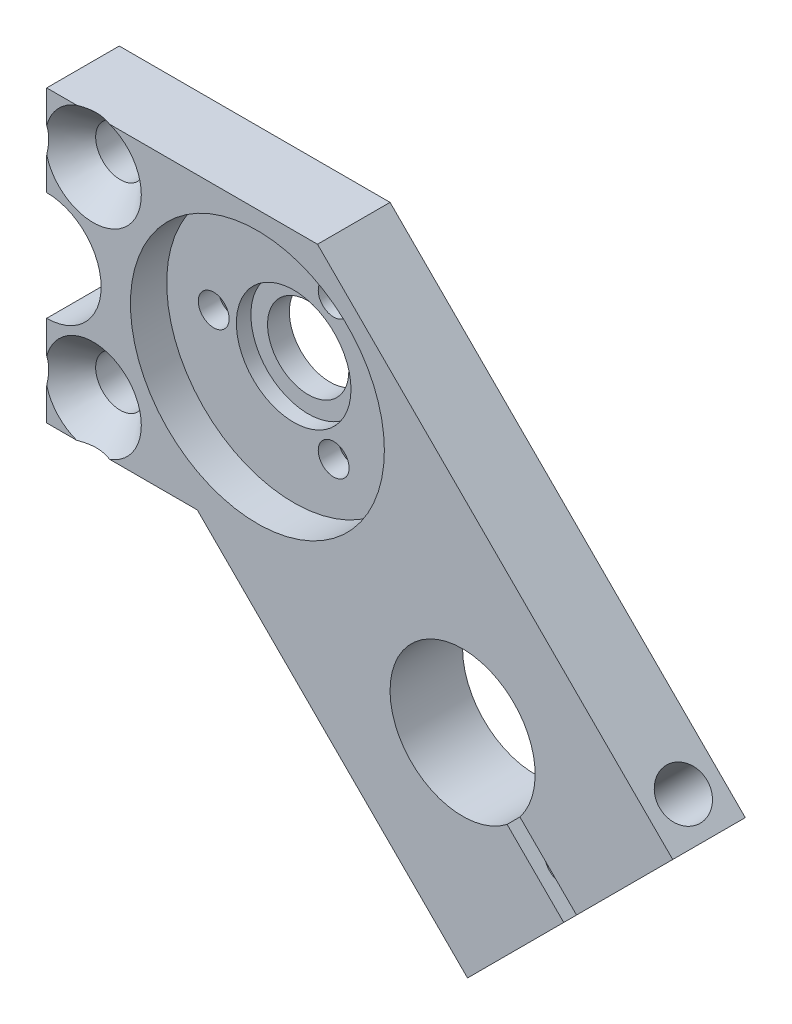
SolidWorks part; units mm, degrees
ref_plane "Front Plane" through (0, 0, 0) normal (0, 0, 1) x (1, 0, 0)
ref_plane "Top Plane" through (0, 0, 0) normal (0, 1, 0) x (1, 0, 0)
ref_plane "Right Plane" through (0, 0, 0) normal (1, 0, 0) x (0, 0, -1)
sketch "Sketch1" plane through (0, 0, 0) normal (0, 0, 1) x (1, 0, 0)
  line L0 (-18.4404, -4.7625) -> (-18.4404, -12.7)
  line L1 (-5.2605, -12.7) -> (18.3916, -36.3521)
  line L2 (18.3916, -36.3521) -> (26.8106, -27.9331)
  line L3 (36.3521, -18.3916) -> (5.2605, 12.7)
  line L4 (0, 0) -> (-24.2979, 0) construction
  line L5 (-13.0393, 13.0393) -> (27.8682, -27.8682) construction
  line L6 (22.9767, -21.8542) -> (27.9331, -26.8106)
  line L7 (26.8106, -27.9331) -> (21.8542, -22.9767)
  line L8 (27.9331, -26.8106) -> (36.3521, -18.3916)
  line L9 (-18.4404, 12.7) -> (-18.4404, 4.7625)
  line L10 (-18.4404, 12.7) -> (5.2605, 12.7)
  line L11 (-18.4404, -12.7) -> (-5.2605, -12.7)
  line L12 (-18.4404, 4.7625) -> (-18.4404, -4.7625) construction
  circle A0 centre (0, 0) radius 3.556
  arc A1 (22.9767, -21.8542) -> (21.8542, -22.9767) centre (17.9605, -17.9605) ccw
  arc A2 (-18.4404, -4.7625) -> (-18.4404, 4.7625) centre (-18.4404, 0) ccw
  dimension "D5" = 7.112
  dimension "D6" = 12.7
  dimension "D7" = 25.4
  dimension "D12" = 12.7
  dimension "D13" = 18.4404
  dimension "D14" = 9.525
  dimension "D16" = 18.4404
  dimension "D2" = 135
  dimension "D3" = 43.9701
  dimension "D4" = 12.7
  dimension "D8" = 0.7937
  dimension "D9" = 1.5875
  dimension "D10" = 25.4
  dimension "D11" = 25.4
  dimension "D15" = 12.7
extrude "Extrude1" add sketch "Sketch1" along normal blind 6.35
hole_wizard "CSK for #8 Flat Head Machine Screw1" positions "3DSketch1" profile "Sketch2" countersink size "#8" standard "Ansi Inch"
sketch3d "3DSketch1"
  line L0 (5.2605, 12.7, 6.35) -> (-18.4404, 12.7, 6.35) construction
  line L1 (-18.4404, -12.7, 6.35) -> (-5.2605, -12.7, 6.35) construction
  line L2 (-18.4404, 12.7, 6.35) -> (-18.4404, 4.7625, 6.35) construction
  point P0 (-14.3764, 8.7376, 6.35)
  point P2 (-14.3764, -8.7376, 6.35)
  dimension "D1" = 3.9624
  dimension "D2" = 3.9624
  dimension "D3" = 4.064
  dimension "D4" = 4.064
sketch "Sketch2" plane through (-14.3764, 8.7376, 6.35) normal (1, 0, 0) x (0, -1, 0)
  line L0 (0, 0) -> (0, 6.35)
  line L1 (0, 6.35) -> (2.1526, 6.35)
  line L2 (2.1526, 6.35) -> (2.1526, 2.3741)
  line L3 (2.1526, 2.3741) -> (4.2164, 0)
  line L5 (4.2164, 0) -> (0, 0)
  line L6 (-2.1526, 2.3741) -> (-4.2164, 0) construction
  line L11 (0, -6.35) -> (0, 107.95) construction
  dimension "Thru Hole Dia." = 4.3053
  dimension "Thru Hole Depth" = 6.35
  dimension "Near C'Sink Dia." = 8.4328
  dimension "Near C'Sink Angle" = 82
sketch "Sketch3" plane through (0, 0, 6.35) normal (0, 0, 1) x (1, 0, 0)
  circle A0 centre (0, 0) radius 11.1125
  dimension "D1" = 22.225
extrude "Cut-Extrude1" cut sketch "Sketch3" against normal blind 3.175
sketch "Sketch4" plane through (0, 0, 3.175) normal (0, 0, 1) x (1, 0, 0)
  circle A0 centre (0, 0) radius 5.0165
  dimension "D1" = 10.033
extrude "Cut-Extrude2" cut sketch "Sketch4" against normal blind 1.27
sketch "Sketch5" plane through (0, 0, 3.175) normal (0, 0, 1) x (1, 0, 0)
  circle A0 centre (0, 0) radius 7.0104 construction
  point P3 (-7.0104, 0)
  dimension "D1" = 14.0208
hole_wizard "CSK for M2.5 Flat Head Machine Screw1" positions "3DSketch2" profile "Sketch6" countersink size "M2.5" standard "Ansi Metric"
sketch3d "3DSketch2"
  point P0 (-7.0004, 0, 0)
sketch "Sketch6" plane through (-7.0004, 0, 0) normal (1, 0, 0) x (0, 1, 0)
  line L0 (0, 0) -> (0, 6.575)
  line L1 (0, 6.575) -> (1.35, 6.575)
  line L2 (1.35, 6.575) -> (1.35, 1.4)
  line L3 (1.35, 1.4) -> (2.75, 0)
  line L5 (2.75, 0) -> (0, 0)
  line L6 (-1.35, 1.4) -> (-2.75, 0) construction
  line L11 (0, -6.35) -> (0, 107.95) construction
  dimension "Thru Hole Dia." = 2.7
  dimension "Thru Hole Depth" = 6.575
  dimension "Near C'Sink Dia." = 5.5
  dimension "Near C'Sink Angle" = 90
pattern_circular "CirPattern1" count 3 over 360 about axis through (0, 0, 0) along (0, 0, 1) of "CSK for M2.5 Flat Head Machine Screw1"
hole_wizard "#8 Clearance Hole1" positions "3DSketch3" profile "Sketch7" hole size "#8" standard "Ansi Inch"
sketch3d "3DSketch3"
  line L0 (-5.2605, -12.7, 0) -> (18.3916, -36.3521, 0) construction
  line L1 (18.3916, -36.3521, 6.35) -> (18.3916, -36.3521, 0) construction
  point P0 (16.1465, -34.107, 3.175)
  dimension "D1" = 3.175
  dimension "D2" = 3.175
sketch "Sketch7" plane through (16.1465, -34.107, 3.175) normal (0, 0, 1) x (0.7071, -0.7071, 0)
  line L0 (0, 0) -> (0, 13.9934)
  line L1 (0, 13.9934) -> (2.1526, 12.7)
  line L2 (2.1526, 12.7) -> (2.1526, 0)
  line L5 (2.1526, 0) -> (0, 0)
  line L10 (0, 13.9934) -> (-2.1527, 12.7) construction
  line L11 (0, -6.35) -> (0, 107.95) construction
  dimension "Hole Dia." = 4.3053
  dimension "Hole Depth" = 12.7
  dimension "Drill Angle" = 118
hole_wizard "#8-32 Tapped Hole1" positions "3DSketch4" profile "Sketch8" tap size "#8-32" standard "Ansi Inch"
sketch3d "3DSketch4"
  line L0 (36.3521, -18.3916, 6.35) -> (36.3521, -18.3916, 0) construction
  line L1 (36.3521, -18.3916, 6.35) -> (5.2605, 12.7, 6.35) construction
  point P0 (34.107, -16.1465, 3.175)
  dimension "D1" = 3.175
  dimension "D2" = 3.175
sketch "Sketch8" plane through (34.107, -16.1465, 3.175) normal (0, 0, 1) x (-0.7071, 0.7071, 0)
  line L0 (0, 0) -> (0, 16.0238)
  line L1 (0, 16.0238) -> (1.7272, 14.986)
  line L2 (1.7272, 14.986) -> (1.7272, 12.7)
  line L3 (1.7272, 12.7) -> (2.0828, 12.7)
  line L4 (2.0828, 12.7) -> (2.0828, 0)
  line L5 (2.0828, 0) -> (0, 0)
  line L10 (0, 16.0238) -> (-1.7272, 14.986) construction
  line L11 (0, -6.35) -> (0, 107.95) construction
  dimension "Tap Drill Dia." = 3.4544
  dimension "Tap Drill Depth" = 14.986
  dimension "Thread Major Dia." = 4.1656
  dimension "Thread Depth" = 12.7
  dimension "Drill Angle" = 118
